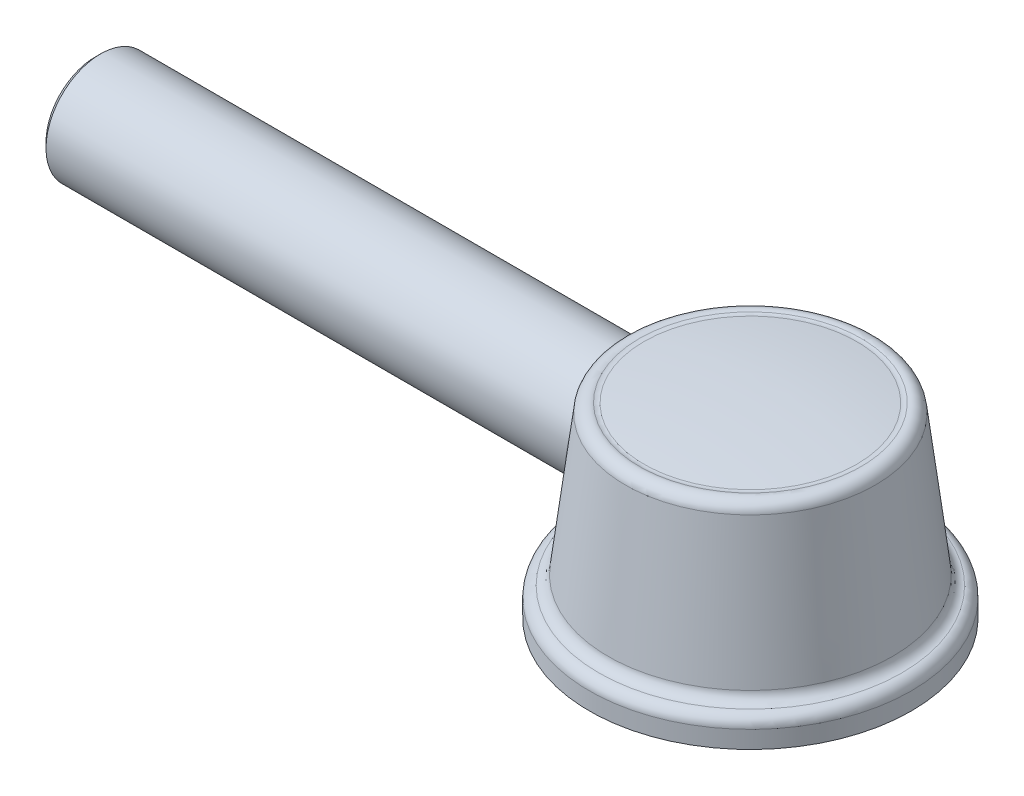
SolidWorks part; units mm, degrees
ref_plane "Plan1" through (0, 0, 0) normal (0, 0, 1) x (1, 0, 0)
ref_plane "Plan2" through (0, 0, 0) normal (0, 1, 0) x (1, 0, 0)
ref_plane "Plan3" through (0, 0, 0) normal (1, 0, 0) x (0, 0, -1)
sketch "Esquisse1" plane through (0, 0, 0) normal (0, 0, 1) x (1, 0, 0)
  line L0 (0, 7) -> (0, 9)
  line L1 (1, 10) -> (100, 10)
  line L2 (100, 10) -> (100, 0)
  line L3 (1, 10) -> (0, 9)
  line L6 (100, 0) -> (59.0415, 0)
  line L7 (59.0415, 0) -> (55, 7)
  line L8 (55, 7) -> (0, 7)
  line L9 (0, 0) -> (126, 0) construction
  dimension "D1" = 100
  dimension "D2" = 45
  dimension "D3" = 1
  dimension "D4" = 10
  dimension "D7" = 14
  dimension "D8" = 55
  dimension "D9" = 60
revolve "Base-Révolution" add sketch "Esquisse1" angle 360 about L9
sketch "Esquisse2" plane through (0, 0, 0) normal (0, 0, 1) x (1, 0, 0)
  line L0 (120, 15.396) -> (120, -41) construction
  line L1 (97.1103, 12.533) -> (93.979, -13.0853)
  line L2 (100, -10) -> (100, 10) construction
  line L3 (90.5137, -20) -> (102, -20)
  line L4 (120, 15.396) -> (120, 12.9109)
  line L5 (102, -20) -> (102, -5)
  line L7 (90.5137, -16.8087) -> (90.5137, -20)
  arc A0 (99.6804, 14.2029) -> (97.1103, 12.533) centre (99.0955, 12.2903) ccw
  arc A1 (92.2538, -14.8257) -> (90.5137, -16.8087) centre (92.5137, -16.8087) ccw
  arc A2 (120, 12.9109) -> (102, -5) centre (120, -5.0893) ccw
  arc A3 (120, 15.396) -> (100.5236, 14.1323) centre (120, -135.3129) ccw
  arc A4 (100.5236, 14.1323) -> (99.6804, 14.2029) centre (100.2652, 16.1155) cw
  arc A5 (93.979, -13.0853) -> (92.2538, -14.8257) centre (91.9938, -12.8427) cw
  dimension "D1" = 2
  dimension "D2" = 2
  dimension "D3" = 2
  dimension "D5" = 18.0002
  dimension "D4" = 20
revolve "Boss.-Révol.1" add sketch "Esquisse2" angle 360 about L0
fillet "Congé1" radius 2
